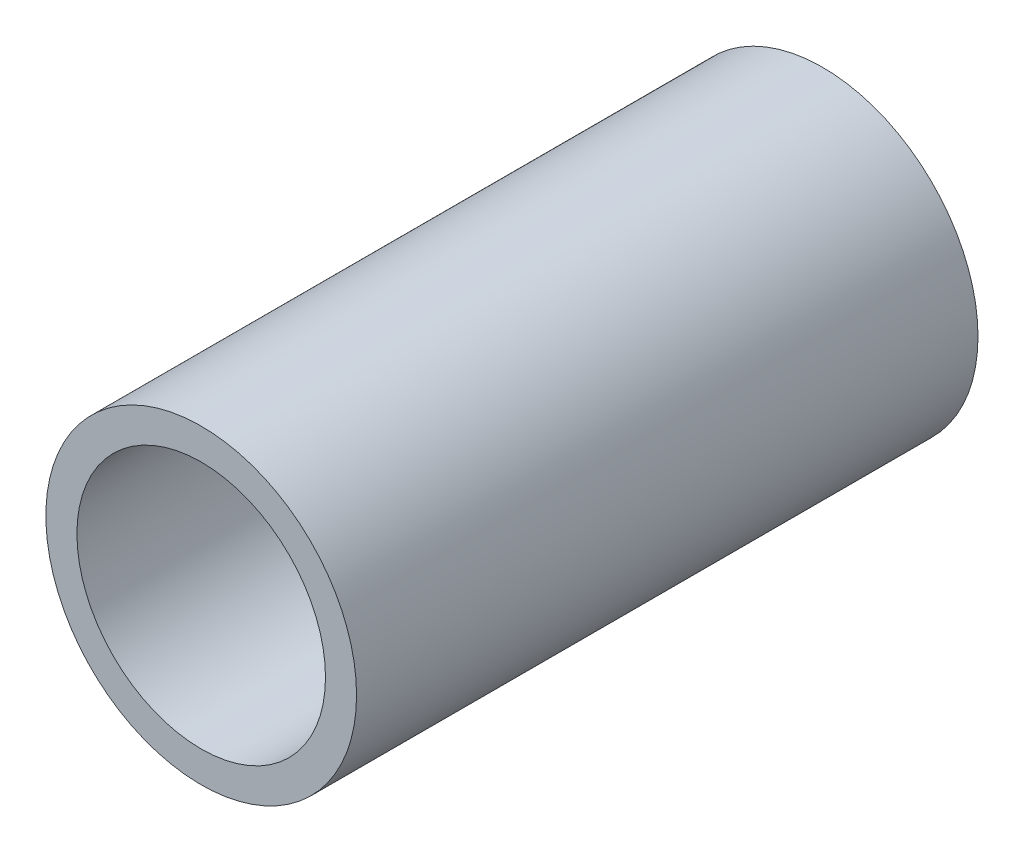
SolidWorks part; units mm, degrees
ref_plane "Plan1" through (0, 0, 0) normal (0, 0, 1) x (1, 0, 0)
ref_plane "Plan2" through (0, 0, 0) normal (0, 1, 0) x (1, 0, 0)
ref_plane "Plan3" through (0, 0, 0) normal (1, 0, 0) x (0, 0, -1)
sketch "Esquisse1" plane through (0, 0, 0) normal (0, 0, 1) x (1, 0, 0)
  circle A0 centre (0, 0) radius 2
  dimension "D1" = 4
extrude "Base-Extrusion" add sketch "Esquisse1" along normal blind 8
sketch "Esquisse2" plane through (0, 0, 8) normal (0, 0, 1) x (1, 0, 0)
  circle A0 centre (0, 0) radius 1.6
extrude "Enlèv. mat.-Extru.1" cut sketch "Esquisse2" against normal through all
